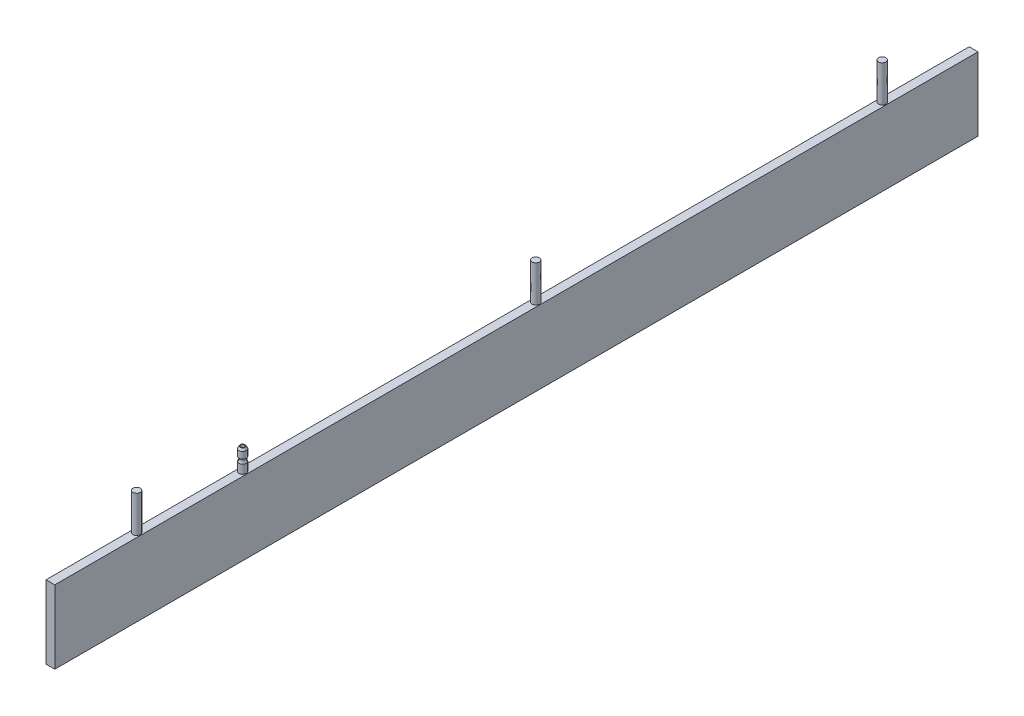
SolidWorks part; units mm, degrees
ref_plane "Plan de face" through (0, 0, 0) normal (0, 0, 1) x (1, 0, 0)
ref_plane "Plan de dessus" through (0, 0, 0) normal (0, 1, 0) x (1, 0, 0)
ref_plane "Plan de droite" through (0, 0, 0) normal (1, 0, 0) x (0, 0, -1)
sketch "Esquisse1" plane through (0, 0, 0) normal (0, 0, 1) x (1, 0, 0)
  line L0 (0, 78.4939) -> (0, -28.954) construction
  line L1 (-6, 100) -> (6, 100)
  line L2 (-6, 100) -> (-6, 0)
  line L3 (6, 0) -> (-6, 0)
  line L5 (6, 100) -> (6, 0)
  dimension "D1" = 12
  dimension "D2" = 100
extrude "Extrusion1" add sketch "Esquisse1" along normal blind 1263
sketch "Esquisse2" plane through (0, 100, 0) normal (0, 1, 0) x (1, 0, 0)
  line L0 (0, 79.4907) -> (0, -1338.8887) construction
  line L1 (6, 0) -> (-6, 0) construction
  circle A0 centre (0, -599) radius 5
  circle A1 centre (0, -125) radius 5
  circle A2 centre (0, -1145) radius 5
  dimension "D1" = 10
  dimension "D3" = 474
  dimension "D2" = 1020
  dimension "D4" = 125
extrude "Extrusion2" add sketch "Esquisse2" along normal blind 50
sketch "Esquisse3" plane through (0, 100, 0) normal (0, 1, 0) x (-1, 0, 0)
  line L1 (6, 1263) -> (6, 0) construction
  circle A0 centre (0, 1000) radius 5
  dimension "D1" = 6
  dimension "D2" = 1000
  dimension "D3" = 10
extrude "Extrusion3" add sketch "Esquisse3" along normal blind 30
chamfer "Chanfrein1" distance 3 angle 30 1 edges at (0, 130, 1005)
sketch "Esquisse4" plane through (0, 130, 0) normal (0, 1, 0) x (1, 0, 0)
  circle A0 centre (0, -1000) radius 2.5
  dimension "D1" = 5
extrude "Extrusion4" cut sketch "Esquisse4" against normal blind 30
ref_axis "Axe1" through (0, 127, 1000) along (0, -1, 0)
sketch "Esquisse5" plane through (0, 0, 0) normal (1, 0, 0) x (0, 0, -1)
  line L1 (-1000, 127) -> (-1000, 100) construction
  line L2 (-1263, 100) -> (0, 100) construction
  circle A0 centre (-1009, 115) radius 5
  dimension "D1" = 10
  dimension "D2" = 9
  dimension "D3" = 15
revolve "Enlèvement de matière-Révolution1" cut sketch "Esquisse5" angle 360 about axis through (0, 127, 1000) along (0, -1, 0)
